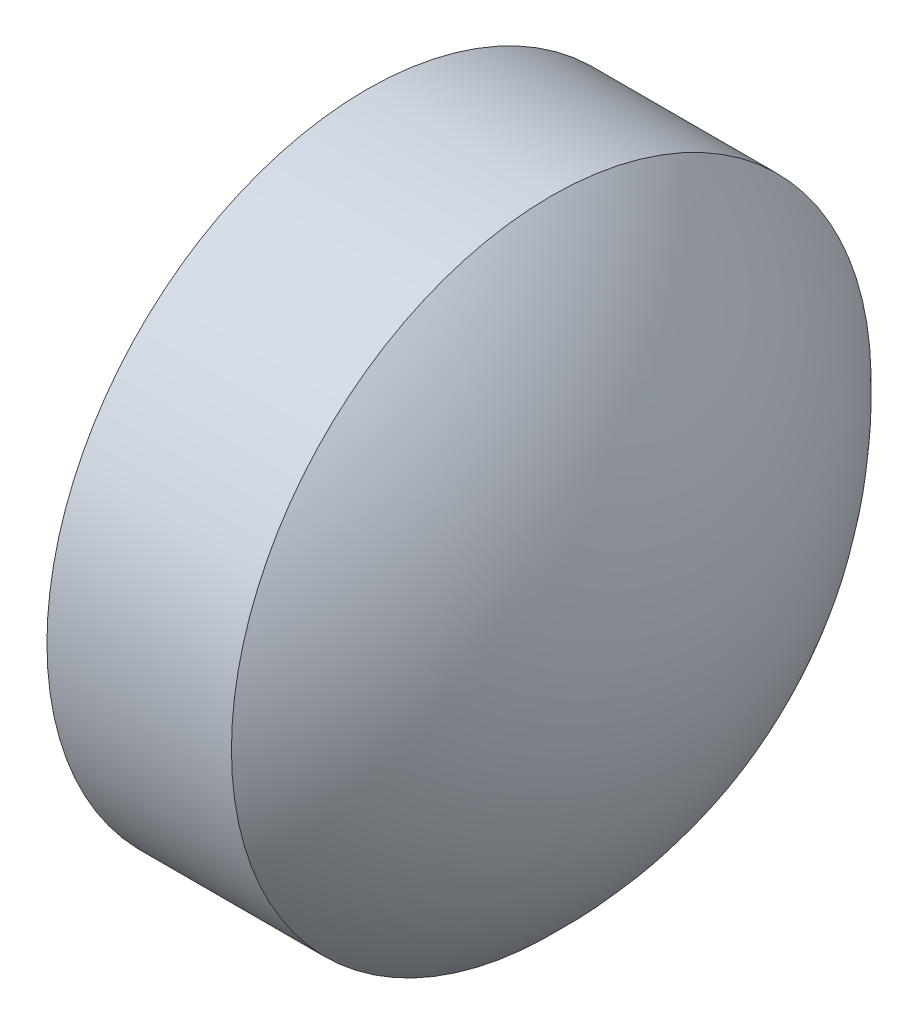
SolidWorks part; units mm, degrees
ref_plane "Vorne" through (0, 0, 0) normal (0, 0, 1) x (1, 0, 0)
ref_plane "Oben" through (0, 0, 0) normal (0, 1, 0) x (1, 0, 0)
ref_plane "Rechts" through (0, 0, 0) normal (1, 0, 0) x (0, 0, -1)
ref_plane "Ebene1" through (0, 0, 8) normal (0, 0, 1) x (1, 0, 0)
sketch "Skizze1" plane through (0, 0, 8) normal (0, 0, 1) x (1, 0, 0)
  line L0 (43.55, 1.75) -> (42.5404, 1.75) construction
  line L1 (0, 0) -> (113.9649, 0) construction
  line L2 (43.55, 1.75) -> (42.5404, 1.75)
  line L3 (0, 0) -> (113.9649, 0) construction
  line L4 (42.045, 0) -> (44.305, 0)
  arc A0 (42.5404, 1.75) -> (42.045, 0) centre (45.3835, 0) ccw construction
  arc A1 (44.305, 0) -> (43.55, 1.75) centre (41.8993, 0) ccw construction
  arc A2 (42.5404, 1.75) -> (42.045, 0) centre (45.3835, 0) ccw
  arc A3 (44.305, 0) -> (43.55, 1.75) centre (41.8993, 0) ccw
revolve "Rotation1" add sketch "Skizze1" angle 360 about L3
